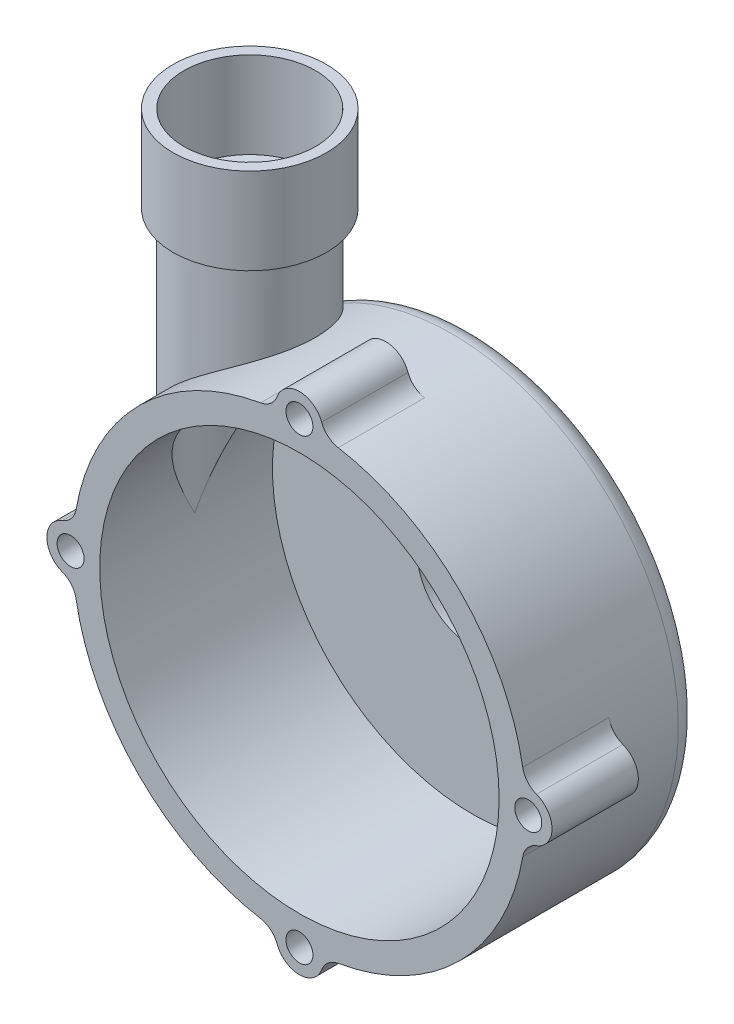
SolidWorks part; units mm, degrees
ref_plane "Alzado" through (0, 0, 0) normal (0, 0, 1) x (1, 0, 0)
ref_plane "Planta" through (0, 0, 0) normal (0, 1, 0) x (1, 0, 0)
ref_plane "Vista lateral" through (0, 0, 0) normal (1, 0, 0) x (0, 0, -1)
sketch "Croquis1" plane through (0, 0, 0) normal (0, 0, 1) x (1, 0, 0)
  circle A0 centre (0, 0) radius 105
  dimension "D1" = 210
extrude "Saliente-Extruir1" add sketch "Croquis1" along normal blind 82
sketch "Croquis2" plane through (0, 0, 0) normal (0, 1, 0) x (1, 0, 0)
  circle A0 centre (-67, -38) radius 25.5
  circle A1 centre (-67, -38) radius 30.5
  dimension "D1" = 51
  dimension "D4" = 61
  dimension "D2" = 38
  dimension "D3" = 38
extrude "Saliente-Extruir2" add sketch "Croquis2" along normal blind 135
sketch "Croquis3" plane through (0, 0, 0) normal (0, 1, 0) x (1, 0, 0)
  circle A0 centre (-67, -38) radius 19
  dimension "D3" = 38
  dimension "D1" = 38
  dimension "D2" = 38
extrude "Cortar-Extruir1" cut sketch "Croquis3" along normal blind 135
sketch "Croquis4" plane through (0, 0, 0) normal (0, 0, -1) x (-1, 0, 0)
  circle A0 centre (0, 0) radius 25.5
  circle A1 centre (0, 0) radius 30.5
  dimension "D1" = 51
  dimension "D2" = 61
extrude "Saliente-Extruir3" add sketch "Croquis4" along normal blind 40
sketch "Croquis5" plane through (0, 0, 0) normal (1, 0, 0) x (0, 0, -1)
  line L0 (0, 0) -> (31.9303, 0) construction
  line L1 (0, 30.5) -> (8, 30.5)
  line L2 (40, 30.5) -> (0, 30.5) construction
  line L3 (0, 30.5) -> (0, 40.5)
  line L4 (0, -105) -> (0, 105) construction
  spline S0 degree 2 poles (0, 40.5) (2.9077, 33.7499) (8, 30.5) knots 0 0 0 0.485736 0.485736 0.485736
  dimension "D1" = 8
  dimension "D2" = 10
revolve "Revolución1" add sketch "Croquis5" angle 360 about L0
sketch "Croquis6" plane through (0, 0, 0) normal (1, 0, 0) x (0, 0, -1)
  line L0 (0, 0) -> (32.6021, 0) construction
  line L2 (0, -105) -> (0, 105) construction
  line L5 (-1.5, 73.8959) -> (-1.5, 105)
  line L6 (-1.5, 105) -> (0, 105)
  line L7 (0, 105) -> (0, 70.5)
  spline S0 degree 2 poles (0, 70.5) (-0.9657, 72.2097) (-1.5, 73.8959) knots 0 0 0 0.128313 0.128313 0.128313
  dimension "D1" = 1.5
  dimension "D2" = 70.5
revolve "Cortar-Revolución1" cut sketch "Croquis6" angle 360 about L0
sketch "Croquis8" plane through (0, 0, 82) normal (0, 0, 1) x (1, 0, 0)
  circle A0 centre (0, 0) radius 92.5
  dimension "D1" = 185
extrude "Cortar-Extruir2" cut sketch "Croquis8" against normal blind 80
sketch "Croquis10" plane through (0, 0, 82) normal (0, 0, 1) x (1, 0, 0)
  circle A0 centre (0, 106) radius 11
  circle A1 centre (106, 0) radius 11
  circle A2 centre (0, -106) radius 11
  circle A3 centre (-106, 0) radius 11
  dimension "D1" = 22
  dimension "D2" = 106
  dimension "D3" = 4
extrude "Saliente-Extruir4" add sketch "Croquis10" against normal blind 40
sketch "Croquis11" plane through (0, 0, 82) normal (0, 0, 1) x (1, 0, 0)
  circle A0 centre (0, 106) radius 6.25
  circle A1 centre (106, 0) radius 6.25
  circle A2 centre (0, -106) radius 6.25
  circle A3 centre (-106, 0) radius 6.25
  dimension "D1" = 12.5
  dimension "D2" = 4
extrude "Cortar-Extruir3" cut sketch "Croquis11" against normal blind 30
fillet "Redondeo1" radius 10 1 edges at (105, 0, 1.5)
sketch "Croquis12" plane through (0, 135, 0) normal (0, 1, 0) x (1, 0, 0)
  circle A0 centre (-67, -38) radius 30.5
  circle A1 centre (-67, -38) radius 35.5
  dimension "D1" = 61
  dimension "D2" = 71
extrude "Saliente-Extruir5" add sketch "Croquis12" along normal blind 40 separate body
sketch "Croquis13" plane through (0, 0, 0) normal (0, 0, -1) x (-1, 0, 0)
  circle A0 centre (0, 0) radius 25.5
  dimension "D1" = 51
extrude "Cortar-Extruir4" cut sketch "Croquis13" against normal up to next
fillet "Redondeo2" radius 10 8 edges at (104.434, -10.888, 62) (104.434, 10.888, 62) (-10.888, -104.434, 62) (10.888, -104.434, 62) (-104.434, 10.888, 62) (-104.434, -10.888, 62) (10.888, 104.434, 62) (-10.888, 104.434, 62)
sketch "Croquis14" plane through (0, 135, 0) normal (0, 1, 0) x (1, 0, 0)
  circle A0 centre (-67, -38) radius 25.5
  dimension "D1" = 51
extrude "Cortar-Extruir5" cut sketch "Croquis14" against normal up to next
